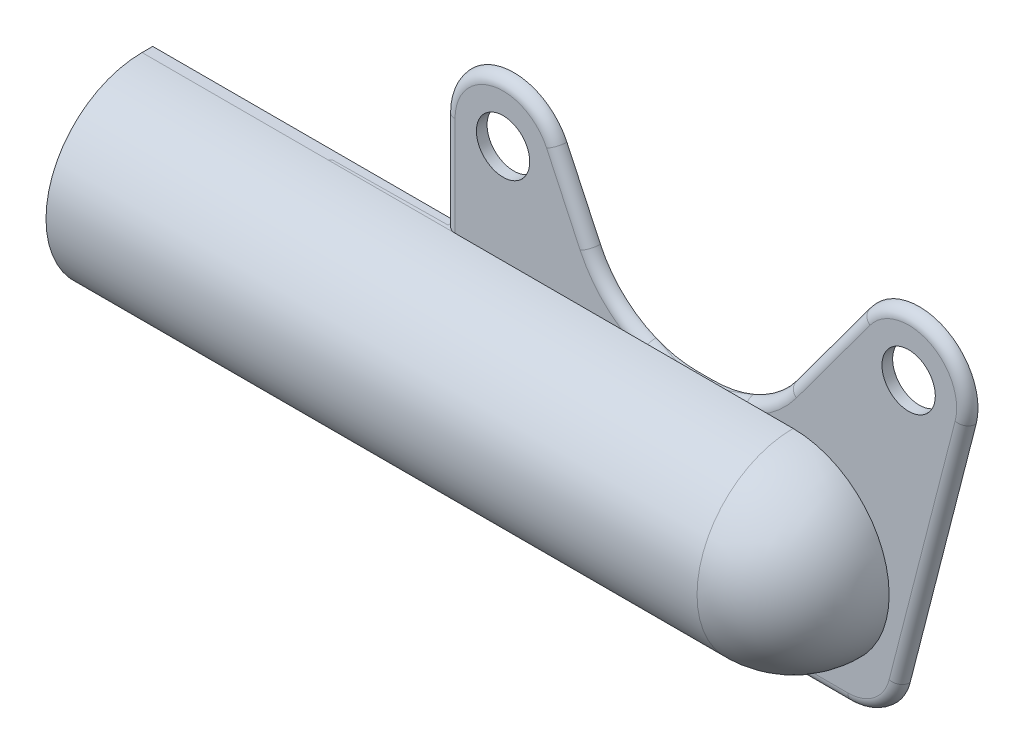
SolidWorks part; units mm, degrees
ref_plane "Plan de face" through (0, 0, 0) normal (0, 0, 1) x (1, 0, 0)
ref_plane "Plan de dessus" through (0, 0, 0) normal (0, 1, 0) x (1, 0, 0)
ref_plane "Plan de droite" through (0, 0, 0) normal (1, 0, 0) x (0, 0, -1)
sketch "Esquisse1" plane through (0, 0, 146.5) normal (0, 0, 1) x (1, 0, 0)
  line L0 (-70.6278, -28.434) -> (67.7683, -28.434) construction
  line L1 (-60.7146, -19.434) -> (0.2854, -19.434)
  line L2 (9.2854, -5.1147) -> (9.2854, -42.9534) construction
  line L3 (0.2854, -20.434) -> (-60.7146, -20.434)
  line L4 (-60.7146, -20.434) -> (-60.7146, -19.434)
  line L5 (8.2854, -28.434) -> (9.2854, -28.434)
  line L6 (24.2854, -46.7536) -> (24.2854, 1.2464) construction
  arc A0 (0.2854, -19.434) -> (9.2854, -28.434) centre (0.2854, -28.434) cw
  arc A1 (0.2854, -20.434) -> (8.2854, -28.434) centre (0.2854, -28.434) cw
  dimension "D1" = 18
  dimension "D3" = 70
  dimension "D4" = 15
  dimension "D2" = 1
revolve "Révolution1" add sketch "Esquisse1" angle 180 about L0
sketch "Esquisse2" plane through (0, 0, 146.5) normal (0, 0, 1) x (1, 0, 0)
  line L4 (-32.3896, -19.434) -> (-60.7146, -19.434)
  line L5 (0.2854, -19.434) -> (-60.7146, -19.434) construction
  line L6 (-16.0695, -20.283) -> (-21.9079, -7.8037)
  line L7 (-32.3896, -39.333) -> (9.2854, -39.333)
  line L8 (-16.0695, -20.283) -> (-3.2058, -20.283)
  line L9 (-60.7146, -19.434) -> (-60.7146, -37.434)
  line L16 (-32.3896, -39.333) -> (-32.3896, -37.434)
  line L18 (-3.2058, -20.283) -> (6.6836, -6.8705)
  line L19 (9.2854, -39.333) -> (16.4373, -11.5034)
  line L20 (-60.7146, -20.434) -> (-60.7146, -19.434) construction
  line L21 (-32.3896, -10.1344) -> (-32.3896, -19.434)
  line L22 (0.2854, -37.434) -> (-60.7146, -37.434) construction
  line L23 (-32.3896, -37.434) -> (-60.7146, -37.434)
  circle A1 centre (11.1104, -10.1344) radius 2.5
  circle A2 centre (11.1104, -10.1344) radius 2.5
  circle A4 centre (-26.8896, -10.1344) radius 2.5
  arc A7 (16.4373, -11.5034) -> (6.6836, -6.8705) centre (11.1104, -10.1344) ccw
  circle A10 centre (11.1104, -10.1344) radius 5.5 construction
  arc A12 (-21.9079, -7.8037) -> (-32.3896, -10.1344) centre (-26.8896, -10.1344) ccw
  circle A14 centre (-26.8896, -10.1344) radius 5.5 construction
  point P2 (16.6104, -10.1344)
  point P10 (-30.1425, -10.1344)
  dimension "D3" = 3
  dimension "D7" = 70
  dimension "D6" = 19.05
  dimension "D1" = 0
  dimension "D5" = 3
extrude "Boss.-Extru.1" add sketch "Esquisse2" against normal blind 1 separate body
sketch "Esquisse3" plane through (0, 0, 146.5) normal (0, 0, 1) x (1, 0, 0)
  line L0 (-70.6278, -28.434) -> (67.7683, -28.434) construction
  line L1 (0.2854, -20.434) -> (-60.7146, -20.434) construction
  line L2 (-70.6278, -28.434) -> (67.7683, -28.434) construction
  line L3 (0.2854, -20.434) -> (-32.3896, -20.434)
  line L4 (0.2854, -36.434) -> (-32.3896, -36.434)
  line L5 (-32.3896, -10.1344) -> (-32.3896, -19.434) construction
  line L6 (-32.3896, -20.434) -> (-32.3896, -36.434)
  arc A0 (8.2854, -28.434) -> (0.2854, -20.434) centre (0.2854, -28.434) ccw construction
  arc A1 (0.2854, -36.434) -> (0.2854, -20.434) centre (0.2854, -28.434) ccw
extrude "Enlèv. mat.-Extru.1" cut sketch "Esquisse3" against normal blind 1
sketch "Esquisse4" plane through (0, 0, 146.5) normal (0, 0, 1) x (1, 0, 0)
  line L0 (-60.7146, -19.434) -> (0.2854, -19.434) construction
  line L1 (-60.7146, -19.434) -> (-32.3896, -19.434)
  line L3 (-70.6278, -28.434) -> (67.7683, -28.434) construction
  line L4 (-70.6278, -28.434) -> (67.7683, -28.434) construction
  line L5 (-60.7146, -37.434) -> (-32.3896, -37.434)
  line L6 (-60.7146, -19.434) -> (-60.7146, -37.434)
  line L7 (-32.3896, -19.434) -> (-32.3896, -37.434)
  line L8 (-32.3896, -10.1344) -> (-32.3896, -19.434) construction
extrude "Boss.-Extru.2" add sketch "Esquisse4" against normal blind 1 separate body
fillet "Congé1" radius 10 2 edges at (-3.2058, -20.283, 146) (-16.0695, -20.283, 146)
fillet "Congé2" radius 5 1 edges at (9.2854, -39.333, 146)
fillet "Congé3" radius 1 10 edges at (-13.4909, -39.333, 146.5) (8.472, -38.2841, 146.5) (13.3439, -23.5405, 146.5) (13.4702, -5.1664, 146.5) (-32.3896, -14.7842, 146.5) (-28.0834, -4.7656, 146.5) (-20.3366, -11.1622, 146.5) (-15.0753, -18.7203, 146.5) (-3.7484, -19.209, 146.5) (3.2377, -11.544, 146.5)
